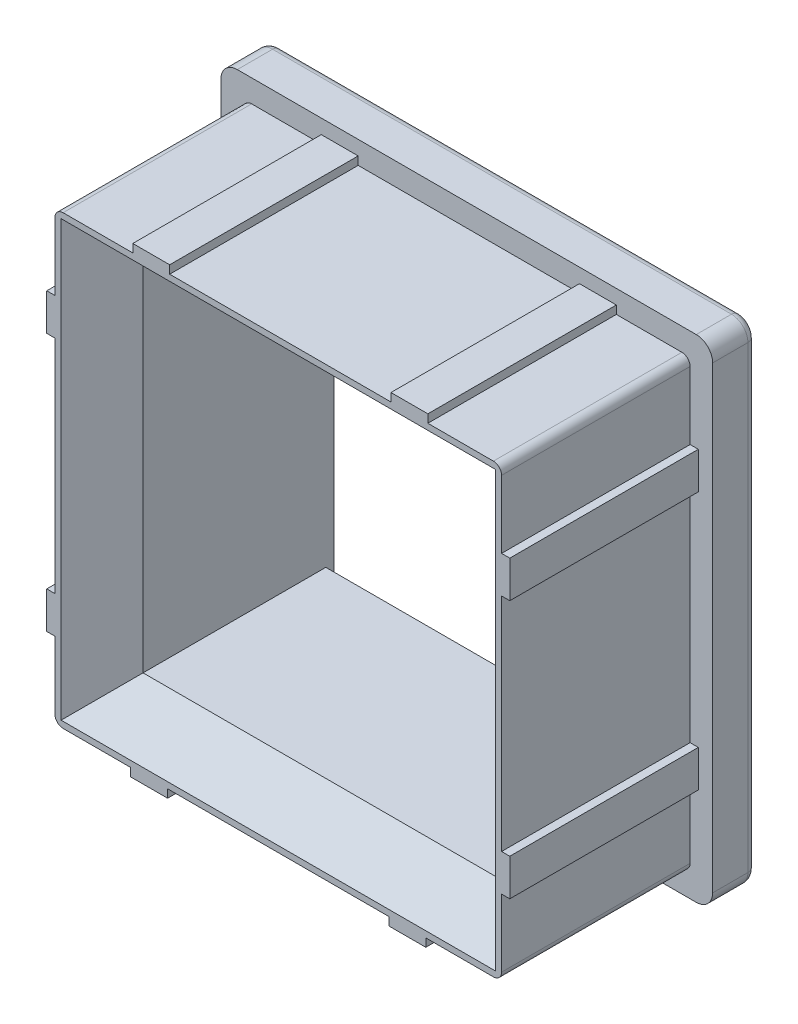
SolidWorks part; units mm, degrees
ref_plane "Plan de face" through (0, 0, 0) normal (0, 0, 1) x (1, 0, 0)
ref_plane "Plan de dessus" through (0, 0, 0) normal (0, 1, 0) x (1, 0, 0)
ref_plane "Plan de droite" through (0, 0, 0) normal (1, 0, 0) x (0, 0, -1)
ref_plane "Plan4" through (0, 0, 5.3) normal (0, 0, 1) x (1, 0, 0)
sketch "Esquisse1" plane through (0, 0, 5.3) normal (0, 0, 1) x (1, 0, 0)
  line L0 (0, 0) -> (60, 0)
  line L1 (60, 0) -> (60, 60)
  line L2 (60, 60) -> (0, 60)
  line L3 (0, 60) -> (0, 0)
  dimension "D1" = 60
  dimension "D2" = 60
extrude "Boss.-Extru.1" add sketch "Esquisse1" against normal blind 5.3
sketch "Esquisse2" plane through (0, 0, 5.3) normal (0, 0, 1) x (1, 0, 0)
  line L0 (58.25, 43.5) -> (57.25, 43.5)
  line L1 (57.25, 43.5) -> (57.25, 16.5)
  line L2 (57.25, 16.5) -> (58.25, 16.5)
  line L3 (58.25, 16.5) -> (58.25, 12)
  line L4 (58.25, 12) -> (57.25, 12)
  line L5 (57.25, 12) -> (57.25, 2.75)
  line L6 (57.25, 2.75) -> (48, 2.75)
  line L7 (48, 2.75) -> (48, 1.75)
  line L8 (48, 1.75) -> (43.5, 1.75)
  line L9 (43.5, 1.75) -> (43.5, 2.75)
  line L10 (43.5, 2.75) -> (16.5, 2.75)
  line L11 (16.5, 2.75) -> (16.5, 1.75)
  line L12 (16.5, 1.75) -> (12, 1.75)
  line L13 (12, 1.75) -> (12, 2.75)
  line L14 (12, 2.75) -> (2.75, 2.75)
  line L15 (2.75, 2.75) -> (2.75, 12)
  line L16 (2.75, 12) -> (1.75, 12)
  line L17 (1.75, 12) -> (1.75, 16.5)
  line L18 (1.75, 16.5) -> (2.75, 16.5)
  line L19 (2.75, 16.5) -> (2.75, 43.5)
  line L20 (2.75, 43.5) -> (1.75, 43.5)
  line L21 (1.75, 43.5) -> (1.75, 48)
  line L22 (1.75, 48) -> (2.75, 48)
  line L23 (2.75, 48) -> (2.75, 57.25)
  line L24 (2.75, 57.25) -> (12.25, 57.25)
  line L25 (12.25, 57.25) -> (12.25, 58.25)
  line L26 (12.25, 58.25) -> (16.75, 58.25)
  line L27 (16.75, 58.25) -> (16.75, 57.25)
  line L28 (16.75, 57.25) -> (43.75, 57.25)
  line L29 (43.75, 57.25) -> (43.75, 58.25)
  line L30 (43.75, 58.25) -> (48.25, 58.25)
  line L31 (48.25, 58.25) -> (48.25, 57.25)
  line L32 (48.25, 57.25) -> (57.25, 57.25)
  line L33 (57.25, 57.25) -> (57.25, 48)
  line L34 (57.25, 48) -> (58.25, 48)
  line L35 (58.25, 48) -> (58.25, 43.5)
  line L36 (0, 60) -> (0, 0) construction
  line L37 (0, 0) -> (60, 0) construction
  dimension "D1" = 9.5
  dimension "D2" = 4.5
  dimension "D3" = 54.5
  dimension "D4" = 4.5
  dimension "D5" = 27
  dimension "D6" = 1
  dimension "D7" = 57.25
  dimension "D8" = 2.75
  dimension "D9" = 1.75
  dimension "D10" = 9.25
  dimension "D11" = 2.75
  dimension "D12" = 16.5
  dimension "D13" = 43.5
  dimension "D14" = 48
  dimension "D15" = 12
  dimension "D16" = 4.5
  dimension "D17" = 1
  dimension "D18" = 43.5
  dimension "D19" = 4.5
  dimension "D20" = 1
extrude "Boss.-Extru.2" add sketch "Esquisse2" along normal blind 23
sketch "Esquisse3" plane through (0, 0, 0) normal (0, 0, -1) x (-1, 0, 0)
  line L0 (-51.5, 51.5) -> (-51.5, 8.5)
  line L1 (-51.5, 8.5) -> (-8.5, 8.5)
  line L2 (-8.5, 8.5) -> (-8.5, 51.5)
  line L3 (-8.5, 51.5) -> (-51.5, 51.5)
  dimension "D1" = 43
  dimension "D2" = 43
  dimension "D3" = 8.5
  dimension "D4" = 8.5
extrude "Enlèv. mat.-Extru.1" cut sketch "Esquisse3" against normal through all
fillet "Congé1" radius 2 1 edges at (0, 60, 2.65)
fillet "Congé2" radius 2 1 edges at (60, 0, 2.65)
fillet "Congé3" radius 2 1 edges at (60, 60, 2.65)
fillet "Congé4" radius 2 1 edges at (0, 0, 2.65)
chamfer "Chanfrein1" distance 1 angle 45 3 edges at (30, 8.5, 0) (51.5, 30, 0) (30, 51.5, 0)
chamfer "Chanfrein2" distance 5 angle 45 4 edges at (51.5, 30, 28.3) (30, 51.5, 28.3) (30, 8.5, 28.3) (8.5, 30, 28.3)
fillet "Congé5" radius 1 1 edges at (57.25, 2.75, 16.8)
fillet "Congé6" radius 1 1 edges at (2.75, 57.25, 16.8)
fillet "Congé7" radius 1 1 edges at (2.75, 2.75, 16.8)
fillet "Congé8" radius 1 1 edges at (57.25, 57.25, 16.8)
fillet "Congé9" radius 1 8 edges at (30, 0, 0) (0.5858, 0.5858, 0) (59.4142, 0.5858, 0) (0, 30, 0) (60, 30, 0) (0.5858, 59.4142, 0) (59.4142, 59.4142, 0) (30, 60, 0)
